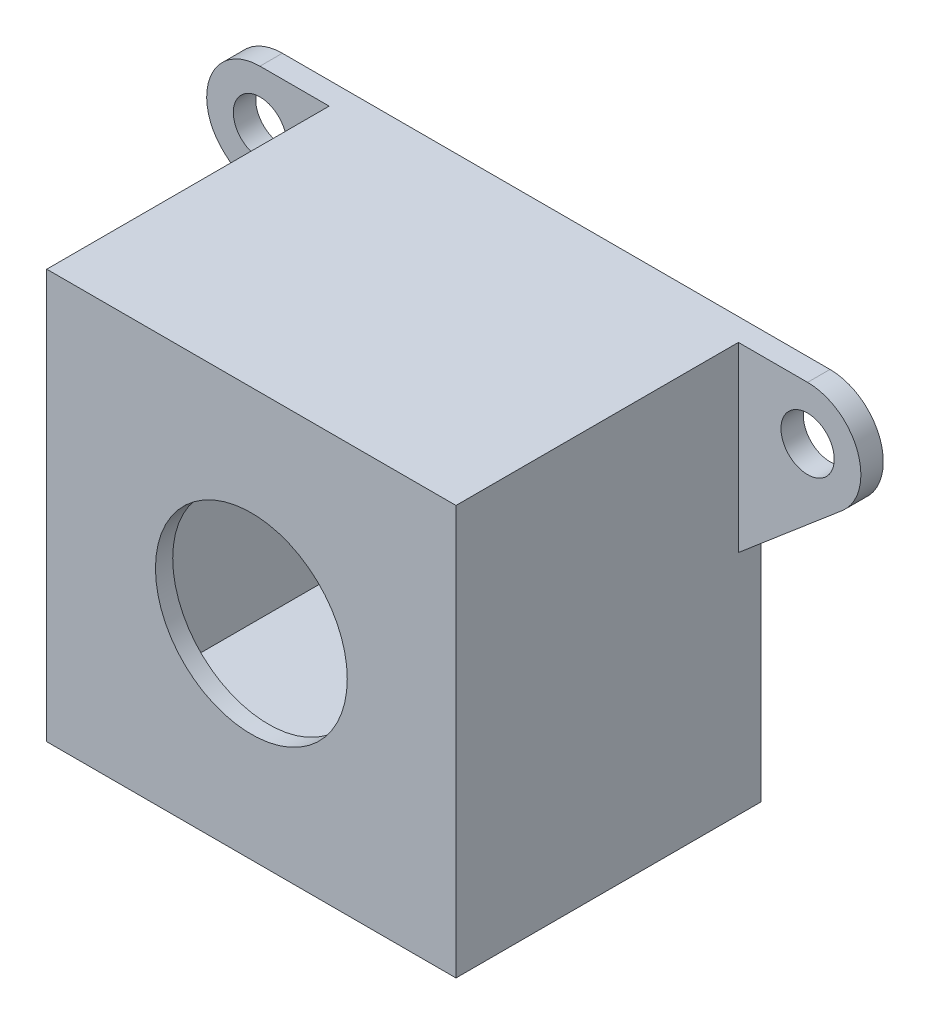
SolidWorks part; units mm, degrees
ref_plane "Front Plane" through (0, 0, 0) normal (0, 0, 1) x (1, 0, 0)
ref_plane "Top Plane" through (0, 0, 0) normal (0, 1, 0) x (1, 0, 0)
ref_plane "Right Plane" through (0, 0, 0) normal (1, 0, 0) x (0, 0, -1)
sketch "Sketch1" plane through (0, 0, 0) normal (0, 0, 1) x (1, 0, 0)
  line L0 (-23.5894, 18.3941) -> (3.9696, 18.3941) construction
  line L1 (-20.4144, 15.2191) -> (0.7946, 15.2191)
  line L2 (-20.4144, 15.2191) -> (-20.4144, -27.1989)
  line L3 (-20.4144, -27.1989) -> (0.7946, -27.1989)
  line L4 (-23.5894, -3.2926) -> (-35.9461, 7.2047)
  line L5 (-31.8349, 18.3941) -> (33.424, 18.3941)
  line L6 (-23.5894, -3.2926) -> (-23.5894, -30.3739)
  line L7 (-23.5894, -30.3739) -> (25.1786, -30.3739)
  line L9 (-23.5894, 18.3941) -> (25.1786, 18.3941)
  line L10 (-23.5894, 18.3941) -> (-23.5894, -30.3739) construction
  line L11 (3.9696, 18.3941) -> (3.9696, -30.3739) construction
  line L12 (-23.5894, -30.3739) -> (3.9696, -30.3739) construction
  line L13 (0.7946, 15.2191) -> (0.7946, -27.1989) construction
  line L14 (25.1786, -3.2926) -> (25.1786, -30.3739)
  line L15 (25.1786, -3.2926) -> (37.5353, 7.2047)
  line L16 (22.0036, -27.1989) -> (0.7946, -27.1989)
  line L17 (22.0036, 15.2191) -> (22.0036, -27.1989)
  line L18 (22.0036, 15.2191) -> (0.7946, 15.2191)
  circle A0 centre (-31.8349, 12.0441) radius 3.175
  arc A1 (37.5353, 7.2047) -> (33.424, 18.3941) centre (33.424, 12.0441) ccw
  arc A2 (-35.9461, 7.2047) -> (-31.8349, 18.3941) centre (-31.8349, 12.0441) cw
  circle A3 centre (33.424, 12.0441) radius 3.175
  point P23 (0.7946, -30.3739)
  point P24 (0.7946, 18.3941)
  dimension "D3" = 6.35
  dimension "D4" = 3.175
  dimension "D2" = 42.418
extrude "Boss-Extrude1" add sketch "Sketch1" along normal blind 2.667 contours A2 L4 L6 L7 L14 L15 A1 L5 L18 L17 L16 L3 L2 L1 A0 A3
sketch "Sketch2" plane through (0, 0, 2.667) normal (0, 0, 1) x (1, 0, 0)
  line L0 (-31.8349, 18.3941) -> (33.424, 18.3941) construction
  line L1 (25.1786, -30.3739) -> (-23.5894, -30.3739)
  line L2 (25.1786, -30.3739) -> (25.1786, 18.3941)
  line L3 (25.1786, 18.3941) -> (-23.5894, 18.3941)
  line L4 (-23.5894, -30.3739) -> (-23.5894, 18.3941)
  line L6 (-20.4144, -27.1989) -> (22.0036, -27.1989)
  line L7 (-20.4144, -27.1989) -> (-20.4144, 15.2191)
  line L8 (-20.4144, 15.2191) -> (22.0036, 15.2191)
  line L9 (22.0036, -27.1989) -> (22.0036, 15.2191)
  dimension "D1" = 48.768
extrude "Boss-Extrude2" add sketch "Sketch2" along normal blind 31.5976
sketch "Sketch3" plane through (0, 0, 34.2646) normal (0, 0, 1) x (1, 0, 0)
  line L1 (-23.5894, 18.3941) -> (25.1786, 18.3941)
  line L2 (-23.5894, 18.3941) -> (-23.5894, -30.3739)
  line L3 (-23.5894, -30.3739) -> (25.1786, -30.3739)
  line L4 (25.1786, 18.3941) -> (25.1786, -30.3739)
  circle A0 centre (0.7946, -5.9899) radius 11.43
  dimension "D1" = 22.86
extrude "Boss-Extrude3" add sketch "Sketch3" along normal blind 2.0574
